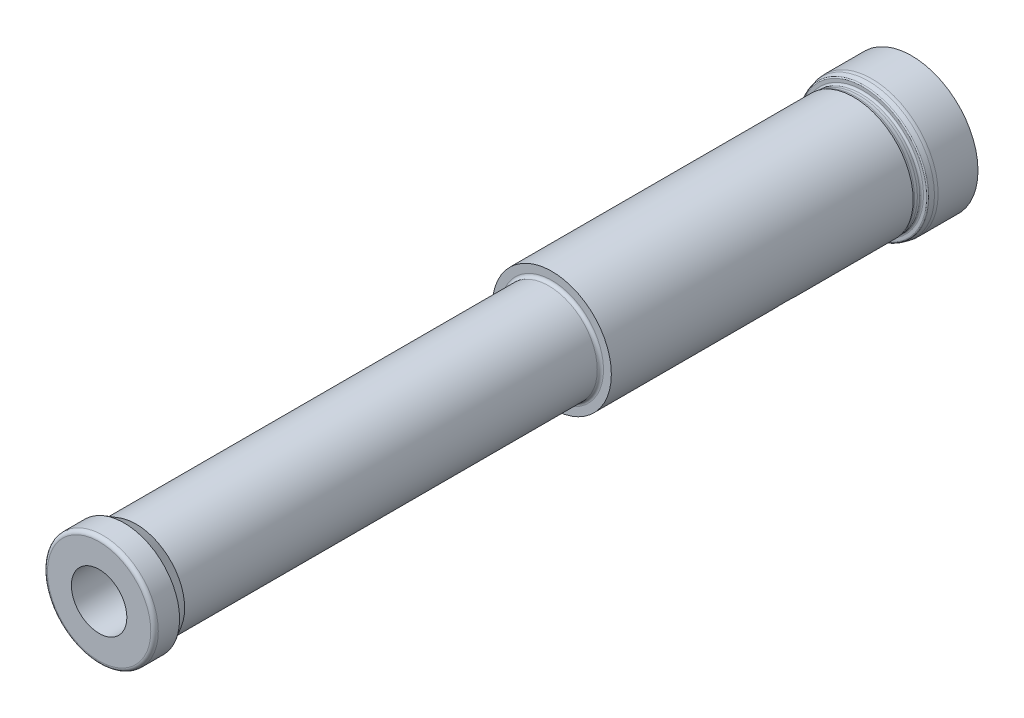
SolidWorks part; units mm, degrees
ref_plane "X-Y" through (0, 0, 0) normal (0, 0, 1) x (1, 0, 0)
ref_plane "X-Z" through (0, 0, 0) normal (0, 1, 0) x (1, 0, 0)
ref_plane "Y-Z" through (0, 0, 0) normal (1, 0, 0) x (0, 0, -1)
sketch "Skizze1" plane through (0, 0, 0) normal (1, 0, 0) x (0, 0, -1)
  line L0 (-20.992, 0) -> (19.1487, 0) construction
  line L1 (0, 4.4275) -> (0, 8.25)
  line L2 (0.6, 8.85) -> (4, 8.85)
  line L3 (4, 8.85) -> (5.9053, 7.75)
  line L4 (5.9053, 7.75) -> (71.8, 7.75)
  line L5 (0, 4.4275) -> (129.75, 4.4275)
  line L6 (72.3, 8.25) -> (72.3, 9.5)
  line L7 (72.3, 9.5) -> (120.5, 9.5)
  line L8 (122, 9.65) -> (122, 10.1465)
  line L9 (123.3829, 10.6) -> (129.75, 10.6)
  line L10 (129.75, 10.6) -> (129.75, 4.4275)
  line L11 (121.7, 9.35) -> (121.3231, 9.35)
  line L12 (120.8055, 9.4181) -> (120.5, 9.5)
  line L13 (122.1482, 10.3397) -> (122.8653, 10.5319)
  line L22 (65.175, 19.1551) -> (65.175, -16.0797) construction
  arc A0 (0, 8.25) -> (0.6, 8.85) centre (0.6, 8.25) cw
  arc A1 (121.3231, 9.35) -> (120.8055, 9.4181) centre (121.3231, 11.35) cw
  arc A2 (121.7, 9.35) -> (122, 9.65) centre (121.7, 9.65) ccw
  arc A3 (122.8653, 10.5319) -> (123.3829, 10.6) centre (123.3829, 8.6) cw
  arc A4 (122.1482, 10.3397) -> (122, 10.1465) centre (122.2, 10.1465) ccw
  arc A5 (71.8, 7.75) -> (72.3, 8.25) centre (71.8, 8.25) ccw
  point P26 (122, 10.3)
  dimension "D10" = 0.6
  dimension "D14" = 2
  dimension "D15" = 0.3
  dimension "D18" = 2
  dimension "D19" = 0.2
  dimension "D27" = 0.5
  dimension "D1" = 17.7
  dimension "D2" = 15.5
  dimension "D3" = 4
  dimension "D4" = 30
  dimension "D5" = 72.3
  dimension "D6" = 19
  dimension "D7" = 122
  dimension "D8" = 129.75
  dimension "D9" = 21.2
  dimension "D11" = 18.7
  dimension "D12" = 1.5
  dimension "D13" = 15
  dimension "D16" = 0.3
  dimension "D17" = 15
  dimension "D20" = 8.855
  dimension "D37" = 65.175
revolve "Rotation1" add sketch "Skizze1" angle 360 about L0
ref_plane "Ebene1" through (0, 0, -80.425) normal (0, 0, 1) x (1, 0, 0)
other "Formnest3"
other "Test_ak_Formnest<1>@Mit_formnest3"
